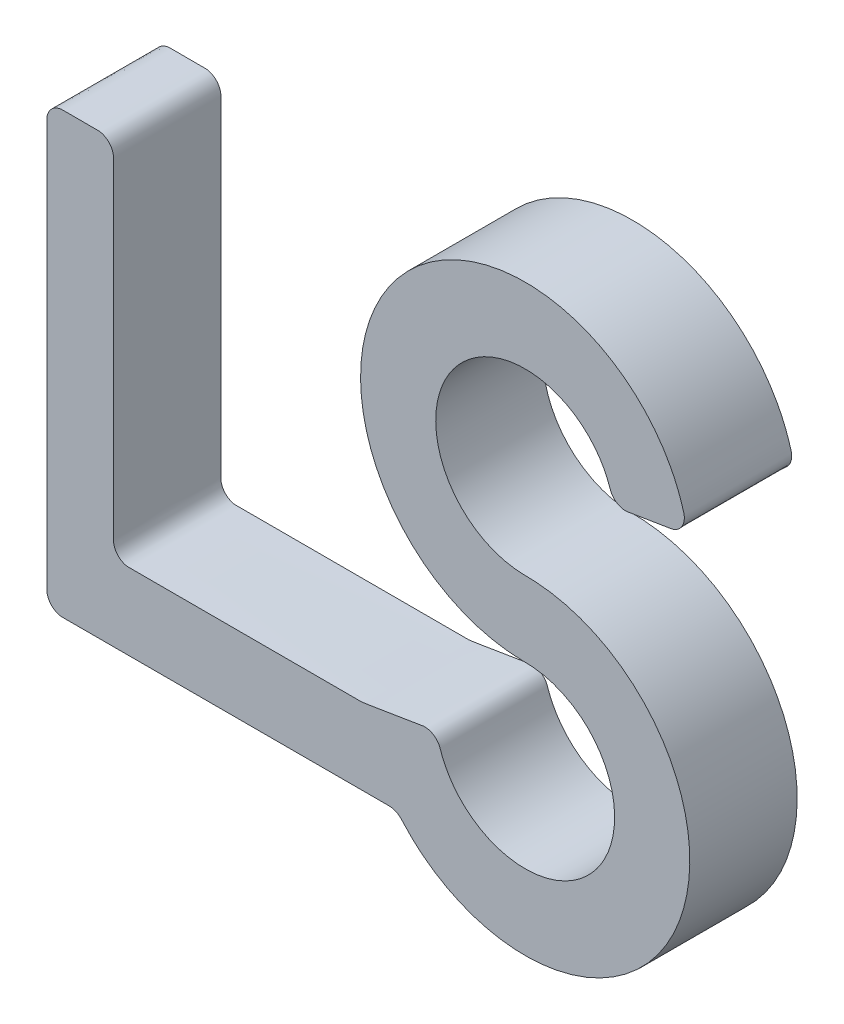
SolidWorks part; units mm, degrees
ref_plane "Ebene vorne" through (0, 0, 0) normal (0, 0, 1) x (1, 0, 0)
ref_plane "Ebene oben" through (0, 0, 0) normal (0, 1, 0) x (1, 0, 0)
ref_plane "Ebene rechts" through (0, 0, 0) normal (1, 0, 0) x (0, 0, -1)
sketch "Skizze1" plane through (0, 0, 0) normal (0, 0, 1) x (1, 0, 0)
  line L0 (0, 78.8586) -> (0, 3)
  line L1 (3, 0) -> (58.8421, 0)
  line L3 (58.5971, 14.2102) -> (15.4089, 14.2102)
  line L4 (12.4089, 17.2102) -> (12.4089, 78.8586)
  line L5 (9.4089, 81.8586) -> (3, 81.8586)
  line L6 (69.9235, 16.0324) -> (59.0839, 14.2499)
  line L7 (116.2355, 70.975) -> (108.2754, 69.6661)
  line L8 (58.8421, 0) -> (63.7806, 0)
  arc A0 (73.2616, 14.0048) -> (89.0994, 35.8492) centre (89.0994, 19.1856) ccw
  arc A1 (104.9373, 71.6936) -> (89.0994, 49.8492) centre (89.0994, 66.5129) ccw
  arc A2 (66.037, -1.0229) -> (89.0994, 49.8492) centre (89.0994, 19.1856) ccw
  arc A3 (118.6387, 74.7402) -> (89.0994, 35.8492) centre (89.0994, 66.5129) ccw
  circle A4 centre (89.0994, 19.1856) radius 16.6637 construction
  circle A5 centre (89.0994, 19.1856) radius 30.6637 construction
  circle A6 centre (89.0994, 66.5129) radius 30.6637 construction
  circle A7 centre (89.0994, 66.5129) radius 16.6637 construction
  arc A8 (59.0839, 14.2499) -> (58.5971, 14.2102) centre (58.5971, 17.2102) cw
  arc A9 (73.2616, 14.0048) -> (69.9235, 16.0324) centre (70.4103, 13.0721) ccw
  arc A10 (63.7806, 0) -> (66.037, -1.0229) centre (63.7806, -3) cw
  arc A11 (104.9373, 71.6936) -> (108.2754, 69.6661) centre (107.7886, 72.6264) ccw
  arc A12 (116.2355, 70.975) -> (118.6387, 74.7402) centre (115.7487, 73.9353) ccw
  arc A13 (12.4089, 78.8586) -> (9.4089, 81.8586) centre (9.4089, 78.8586) ccw
  arc A14 (0, 78.8586) -> (3, 81.8586) centre (3, 78.8586) cw
  arc A15 (0, 3) -> (3, 0) centre (3, 3) ccw
  arc A16 (15.4089, 14.2102) -> (12.4089, 17.2102) centre (15.4089, 17.2102) cw
  point P37 (0, 0)
  dimension "D3" = 3
  dimension "D1" = 14
  dimension "D2" = 14
sketch "Skizze4" plane through (0, 0, 0) normal (0, 0, 1) x (1, 0, 0)
  line L0 (12.4089, 17.2102) -> (12.4089, 78.8586) construction
  line L1 (58.5971, 14.2102) -> (15.4089, 14.2102) construction
  line L2 (69.9235, 16.0324) -> (59.0839, 14.2499) construction
  line L3 (116.2355, 70.975) -> (108.2754, 69.6661) construction
  line L4 (58.8421, 0) -> (63.7806, 0) construction
  line L5 (3, 0) -> (58.8421, 0) construction
  line L6 (0, 78.8586) -> (0, 3) construction
  line L7 (9.4089, 81.8586) -> (3, 81.8586) construction
  arc A0 (12.4089, 17.2102) -> (15.4089, 14.2102) centre (15.4089, 17.2102) ccw construction
  arc A1 (58.5971, 14.2102) -> (59.0839, 14.2499) centre (58.5971, 17.2102) ccw construction
  arc A2 (73.2616, 14.0048) -> (69.9235, 16.0324) centre (70.4103, 13.0721) ccw construction
  arc A3 (73.2616, 14.0048) -> (89.0994, 35.8492) centre (89.0994, 19.1856) ccw construction
  arc A4 (118.6387, 74.7402) -> (89.0994, 35.8492) centre (89.0994, 66.5129) ccw construction
  arc A5 (116.2355, 70.975) -> (118.6387, 74.7402) centre (115.7487, 73.9353) ccw construction
  arc A6 (104.9373, 71.6936) -> (108.2754, 69.6661) centre (107.7886, 72.6264) ccw construction
  arc A7 (104.9373, 71.6936) -> (89.0994, 49.8492) centre (89.0994, 66.5129) ccw construction
  arc A8 (66.037, -1.0229) -> (89.0994, 49.8492) centre (89.0994, 19.1856) ccw construction
  arc A9 (66.037, -1.0229) -> (63.7806, 0) centre (63.7806, -3) ccw construction
  arc A10 (0, 3) -> (3, 0) centre (3, 3) ccw construction
  arc A11 (3, 81.8586) -> (0, 78.8586) centre (3, 78.8586) ccw construction
  arc A12 (12.4089, 78.8586) -> (9.4089, 81.8586) centre (9.4089, 78.8586) ccw construction
  spline S0 degree 3 number of poles 248 (12.4089, 18.3807) -> (12.4089, 18.3807)
extrude "Linear austragen1" add sketch "Skizze4" against normal blind 20
equation "\"LÄNGE\"=0"
equation "\"BREITE\"=0"
equation "\"HÖHE\"=0"
equation "\"DURCHMESSER\"=0"
equation "\"Stückzahl\"= 1"
